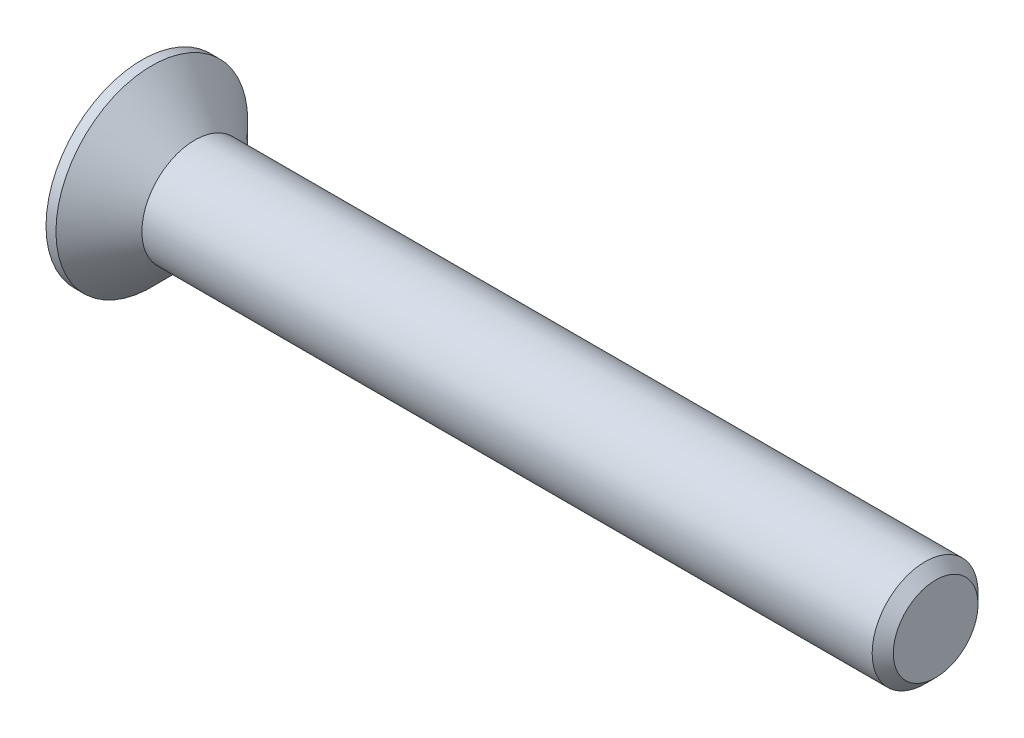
SolidWorks part; units mm, degrees
ref_plane "Front Plane" through (0, 0, 0) normal (0, 0, 1) x (1, 0, 0)
ref_plane "Top Plane" through (0, 0, 0) normal (0, 1, 0) x (1, 0, 0)
ref_plane "Right Plane" through (0, 0, 0) normal (1, 0, 0) x (0, 0, -1)
sketch "Sketch1" plane through (0, 0, 0) normal (0, 0, 1) x (1, 0, 0)
  line L1 (-4, 7.25) -> (-4, 0)
  line L2 (-4, 0) -> (56, 0)
  line L3 (56, 0) -> (56, 4)
  line L4 (56, 4) -> (0, 4)
  line L5 (-4, 7.25) -> (-3.25, 7.25)
  line L6 (-3.25, 7.25) -> (0, 4)
  dimension "D1" = 4
  dimension "D2" = 45
  dimension "D3" = 4
  dimension "D4" = 60
  dimension "D5" = 7.25
revolve "Revolve1" add sketch "Sketch1" angle 360 about L2
chamfer "Chamfer1" distance 0.8 angle 45 1 edges at (56, 0, 4)
sketch "Sketch2" plane through (-4, 0, 0) normal (-1, 0, 0) x (0, 0, 1)
  line L0 (-1.09, 4.35) -> (1.09, 4.35)
  line L1 (1.09, 4.35) -> (1.09, 1.09)
  line L2 (1.09, 1.09) -> (4.35, 1.09)
  line L3 (4.35, 1.09) -> (4.35, -1.09)
  line L4 (4.35, -1.09) -> (1.09, -1.09)
  line L5 (1.09, -1.09) -> (1.09, -4.35)
  line L6 (1.09, -4.35) -> (-1.09, -4.35)
  line L7 (-1.09, -4.35) -> (-1.09, -1.09)
  line L8 (-1.09, -1.09) -> (-4.35, -1.09)
  line L9 (-4.35, -1.09) -> (-4.35, 1.09)
  line L10 (-4.35, 1.09) -> (-1.09, 1.09)
  line L11 (-1.09, 1.09) -> (-1.09, 4.35)
  point P2 (0, 4.35)
  point P14 (0, -4.35)
  point P15 (4.35, 0)
  point P16 (-4.35, 0)
  dimension "D1" = 8.7
  dimension "D2" = 2.18
extrude "Cut-Extrude1" cut sketch "Sketch2" against normal blind 3.45
